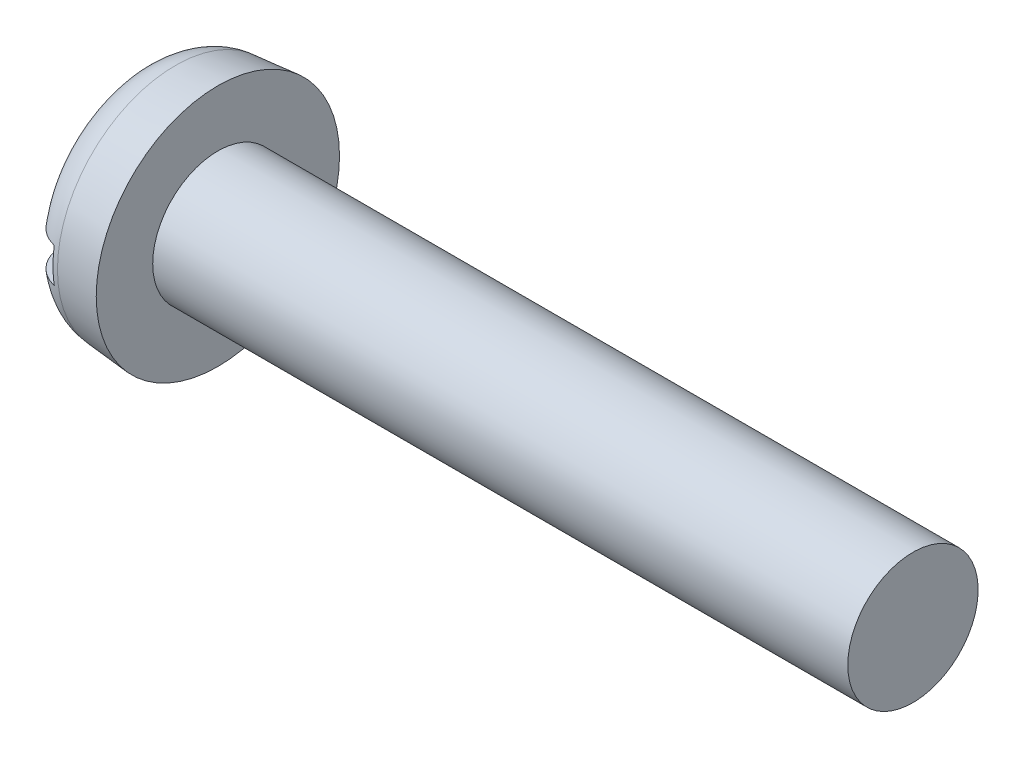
SolidWorks part; units mm, degrees
ref_plane "Plane1" through (0, 0, 0) normal (0, 0, 1) x (1, 0, 0)
ref_plane "Plane2" through (0, 0, 0) normal (0, 1, 0) x (1, 0, 0)
ref_plane "Plane3" through (0, 0, 0) normal (1, 0, 0) x (0, 0, -1)
sketch "BodySke" plane through (0, 0, 0) normal (0, 0, 1) x (1, 0, 0)
  line L0 (1.8, 1.5) -> (1.8, 2.8)
  line L1 (0, 0) -> (0, 2.6425)
  line L2 (-25.4, 0) -> (127, 0) construction
  line L3 (17.8, 0) -> (0, 0)
  line L4 (1.8, 1.5) -> (17.8, 1.5)
  line L5 (17.8, 1.5) -> (17.8, 0)
  line L6 (0, 2.6425) -> (1.8, 2.8)
  line L9 (2.3, 3.0875) -> (2.3, -6.4375) construction
  line L10 (1.8, 6.35) -> (1.8, -3.175) construction
  dimension "Head_ht" = 1.8
  dimension "Diameter" = 3
  dimension "Length" = 16
  dimension "Head_dia" = 5.6
  dimension "Advance" = 0.5
  dimension "Thread_nom" = 16
  dimension "Head_side_angle" = 5
revolve "Base-Revolve" add sketch "BodySke"
fillet "Fillet1" [suppressed] radius 0.1
fillet "Fillet2" radius 0.9 1 edges at (0, 0, 2.6425)
sketch "Sketch2" plane through (0, 0, 0) normal (1, 0, 0) x (0, 0, -1)
  line L0 (2.8, -0.4) -> (-2.8, -0.4)
  line L1 (2.8, -0.4) -> (2.8, 0.4)
  line L2 (-2.8, 0.4) -> (2.8, 0.4)
  line L3 (-2.8, 0.4) -> (-2.8, -0.4)
  dimension "D1" = 5.6
  dimension "D2" = 2.8
  dimension "Slot_width" = 0.8
  dimension "D3" = 0.4
extrude "Slot" cut sketch "Sketch2" along normal blind 0.7
sketch "ThdSchSke" plane through (0, 0, 0) normal (0, 0, 1) x (1, 0, 0)
  line L0 (2.8, -1.2195) -> (2.6036, -1.5)
  line L1 (2.8, -1.2195) -> (2.9964, -1.5)
  line L2 (2.9964, -1.5) -> (2.9964, -1.875)
  line L3 (-3.175, 0) -> (5.1513, 0) construction
  line L5 (2.9964, -1.875) -> (2.6036, -1.875)
  line L6 (2.6036, -1.875) -> (2.6036, -1.5)
  dimension "Thread_minor" = 2.439
  dimension "Diameter" = 3
  dimension "Start" = 2.8
  dimension "SideAngle" = 55
  dimension "VeeAngle" = 70
  dimension "Overcut" = 3.75
revolve "ThreadSchematic" [suppressed] cut sketch "ThdSchSke" angle 360 about L3
pattern_linear "ThdSchPat" [suppressed]
equation "\"D1@Sketch2\" = \"Head_dia@BodySke\""
equation "\"D2@Sketch2\" = \"D1@Sketch2\" / 2"
equation "\"D3@Sketch2\" = \"Slot_width@Sketch2\" / 2"
equation "\"Thread_length@ThreadCosmetic\" = ((sgn( (\"Length@BodySke\" - \"Advance@BodySke\" * 2.0 ) - \"Thread_nom@BodySke\" )-1)*( (\"Length@BodySke\" - \"Advance@BodySke\"  * 2.0) - \"Thread_nom@BodySke\" ))/-2+ \"Thread_"
equation "\"Thread_minor@ThdSchSke\" = \"Thread_minor@ThreadCosmetic\""
equation "\"Diameter@ThdSchSke\" = \"Diameter@BodySke\""
equation "\"Overcut@ThdSchSke\" = \"Diameter@BodySke\" * 1.25"
equation "\"Start@ThdSchSke\" = \"Head_ht@BodySke\" + \"Length@BodySke\" - \"Thread_length@ThreadCosmetic\"  '---Non-countersunk---"
equation "\"Num_threads@ThdSchPat\" = int( \"Thread_length@ThreadCosmetic\" / \"Advance@BodySke\" + 0.999 )  + 1"
equation "\"Advance@ThdSchPat\" = \"Thread_length@ThreadCosmetic\" /  (\"Num_threads@ThdSchPat\" - 1) 'relax it"
